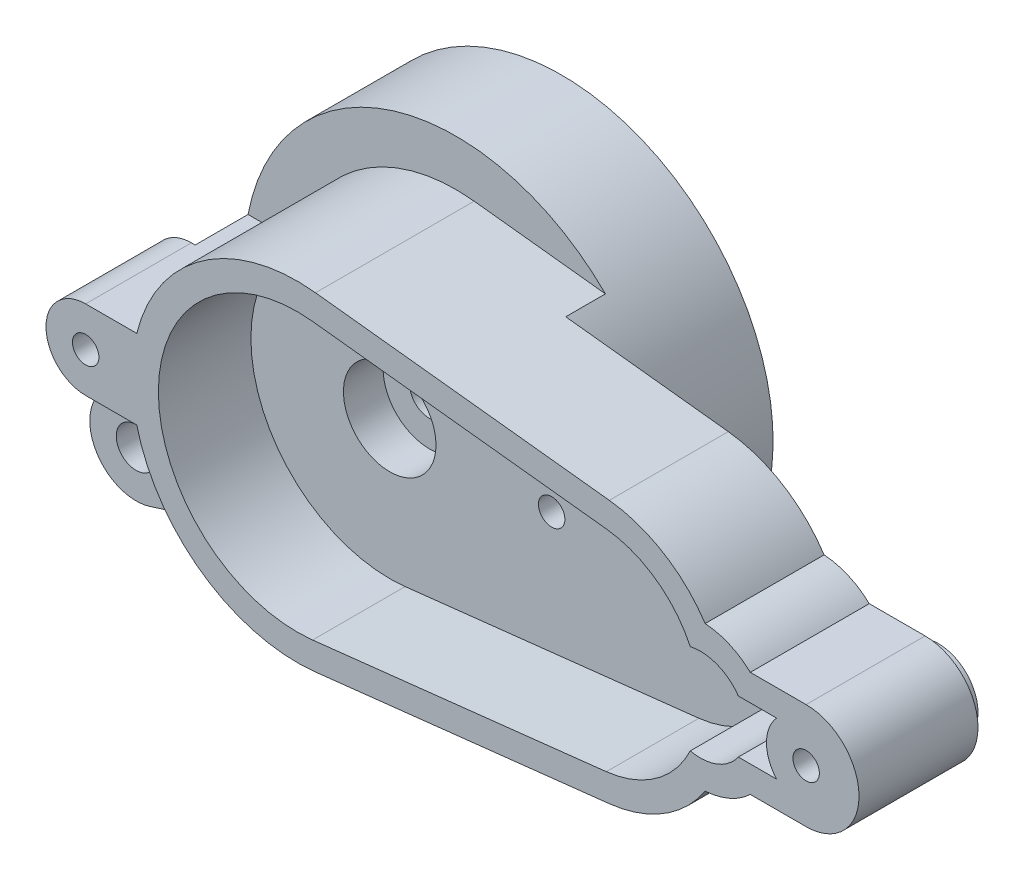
SolidWorks part; units mm, degrees
ref_plane "Face" through (0, 0, 0) normal (0, 0, 1) x (1, 0, 0)
ref_plane "Dessus" through (0, 0, 0) normal (0, 1, 0) x (1, 0, 0)
ref_plane "Droite" through (0, 0, 0) normal (1, 0, 0) x (0, 0, -1)
sketch "Esquisse1" plane through (0, 0, 0) normal (0, 0, 1) x (1, 0, 0)
  line L0 (8, 0) -> (0, 0) construction
  line L1 (8, 4) -> (3.7749, 4)
  line L2 (8, -4) -> (3.7749, -4)
  line L7 (-6.8889, 9.9381) -> (-29.1111, 12.4226)
  line L8 (-29.1111, -12.4226) -> (-6.8889, -9.9381)
  arc A0 (-6.8889, 9.9381) -> (0.3594, 5.4882) centre (-8, 0) cw
  arc A1 (0.3594, -5.4882) -> (3.7749, -4) centre (0, 0) ccw
  arc A2 (0.3594, -5.4882) -> (-6.8889, -9.9381) centre (-8, 0) cw
  arc A3 (8, -4) -> (8, 4) centre (8, 0) ccw
  arc A4 (3.7749, 4) -> (0.3594, 5.4882) centre (0, 0) ccw
  arc A8 (-29.1111, 12.4226) -> (-29.1111, -12.4226) centre (-30.5, 0) ccw
  dimension "D2" = 11
  dimension "D1" = 12.5
  dimension "D3" = 10
  dimension "D6" = 8
  dimension "D4" = 30.5
  dimension "D5" = 8
  dimension "D7" = 8
extrude "Forme de base" add sketch "Esquisse1" against normal blind 9
shell "Coque1" thickness 2
sketch "Esquisse2" plane through (0, 0, 0) normal (0, 0, 1) x (1, 0, 0)
  circle A0 centre (8, 0) radius 3
  arc A1 (8, -4) -> (8, 4) centre (8, 0) ccw construction
  dimension "D1" = 6
extrude "Bossage" add sketch "Esquisse2" against normal blind 10
sketch "Esquisse3" plane through (0, 0, 0) normal (0, 0, 1) x (1, 0, 0)
  circle A0 centre (8, 0) radius 1
  arc A1 (8, -4) -> (8, 4) centre (8, 0) ccw construction
  dimension "D1" = 2
extrude "Trou vis extreme" cut sketch "Esquisse3" against normal through all
sketch "Esquisse4" plane through (0, 0, -7) normal (0, 0, 1) x (1, 0, 0)
  circle A0 centre (0, 0) radius 1.5
  dimension "D1" = 3
extrude "Passage axe moteur" cut sketch "Esquisse4" against normal through all
sketch "Esquisse5" plane through (0, 0, -9) normal (0, 0, -1) x (-1, 0, 0)
  circle A0 centre (8, 0) radius 2.5
  arc A1 (6.8889, 9.9381) -> (-0.3594, 5.4882) centre (8, 0) ccw construction
  dimension "D1" = 5
extrude "Bossage axe intermédiaire" add sketch "Esquisse5" along normal blind 2
sketch "Esquisse6" plane through (0, 0, -7) normal (0, 0, 1) x (1, 0, 0)
  circle A0 centre (-8, 0) radius 1
  circle A1 centre (-8, 0) radius 2.5 construction
  dimension "D1" = 2
extrude "Logement axe intermédiaire" cut sketch "Esquisse6" against normal blind 3
pattern_linear "Répétition linéaire1" count 2 spacing 10.25 along (-1, 0, 0)
sketch "Esquisse7" plane through (0, 0, -9) normal (0, 0, -1) x (-1, 0, 0)
  line L4 (-8, -4) -> (-3.7749, -4)
  line L5 (6.8889, -9.9381) -> (29.1111, -12.4226)
  line L6 (29.1111, 12.4226) -> (6.8889, 9.9381)
  line L7 (-3.7749, 4) -> (-8, 4)
  line L9 (19.1855, -11.3129) -> (29.1111, -12.4226)
  line L10 (29.1111, 12.4226) -> (19.1855, 11.3129)
  arc A0 (19.1855, 11.3129) -> (19.1855, -11.3129) centre (30.5, 0) ccw
  arc A1 (29.1111, -12.4226) -> (29.1111, 12.4226) centre (30.5, 0) ccw construction
  arc A8 (-8, 4) -> (-8, -4) centre (-8, 0) ccw
  arc A9 (-3.7749, -4) -> (-0.3594, -5.4882) centre (0, 0) ccw
  arc A10 (-0.3594, -5.4882) -> (6.8889, -9.9381) centre (8, 0) ccw
  arc A11 (29.1111, -12.4226) -> (29.1111, 12.4226) centre (30.5, 0) ccw
  arc A12 (6.8889, 9.9381) -> (-0.3594, 5.4882) centre (8, 0) ccw
  arc A13 (-0.3594, 5.4882) -> (-3.7749, 4) centre (0, 0) ccw
  arc A17 (29.1111, -12.4226) -> (29.1111, 12.4226) centre (30.5, 0) ccw
  dimension "D1" = 32
  dimension "D2" = 0
extrude "Logement axe de sortie" add sketch "Esquisse7" along normal blind 3 thin
sketch "Esquisse8" plane through (0, 0, -12) normal (0, 0, -1) x (-1, 0, 0)
  circle A0 centre (30.5, 0) radius 16
  arc A2 (19.1855, 11.3129) -> (19.1855, -11.3129) centre (30.5, 0) ccw construction
extrude "Logement de sortie" add sketch "Esquisse8" along normal blind 8 thin
sketch "Esquisse9" plane through (0, 0, -12) normal (0, 0, -1) x (-1, 0, 0)
  line L4 (29.1111, 12.4226) -> (22.8454, 11.7221)
  line L5 (20.1305, 9.4061) -> (29.3333, 10.435)
  line L6 (29.3333, -10.435) -> (20.1305, -9.4061)
  line L7 (22.8454, -11.7221) -> (29.1111, -12.4226)
  line L9 (20.1305, 9.4061) -> (29.3333, 10.435)
  line L10 (29.3333, -10.435) -> (20.1305, -9.4061)
  circle A0 centre (30.5, 0) radius 14 construction
  arc A1 (22.8454, -11.7221) -> (22.8454, 11.7221) centre (30.5, 0) ccw
  arc A4 (22.8454, 11.7221) -> (20.1305, 9.4061) centre (30.5, 0) ccw
  arc A5 (29.3333, -10.435) -> (29.3333, 10.435) centre (30.5, 0) ccw
  arc A6 (20.1305, -9.4061) -> (22.8454, -11.7221) centre (30.5, 0) ccw
  arc A7 (29.1111, -12.4226) -> (29.1111, 12.4226) centre (30.5, 0) ccw
  arc A8 (22.8454, 11.7221) -> (20.1305, 9.4061) centre (30.5, 0) ccw
  arc A9 (29.3333, -10.435) -> (29.3333, 10.435) centre (30.5, 0) ccw
  arc A10 (20.1305, -9.4061) -> (22.8454, -11.7221) centre (30.5, 0) ccw
  dimension "D1" = 0
extrude "Fond intermédiaire logement" add sketch "Esquisse9" along normal blind 2
sketch "Esquisse10" plane through (0, 0, -9) normal (0, 0, -1) x (-1, 0, 0)
  circle A0 centre (30.5, 0) radius 5
  arc A1 (29.3333, -10.435) -> (29.3333, 10.435) centre (30.5, 0) ccw construction
  dimension "D1" = 10
extrude "Bossage sortie" add sketch "Esquisse10" along normal blind 2
sketch "Esquisse11" plane through (0, 0, -7) normal (0, 0, 1) x (1, 0, 0)
  circle A0 centre (-30.5, 0) radius 3.5
  arc A1 (-29.3333, 10.435) -> (-29.3333, -10.435) centre (-30.5, 0) ccw construction
  dimension "D1" = 7
extrude "Logement coussinet sortie" cut sketch "Esquisse11" against normal blind 3
sketch "Esquisse12" plane through (0, 0, -11) normal (0, 0, -1) x (-1, 0, 0)
  circle A0 centre (30.5, 0) radius 1.5
  circle A1 centre (30.5, 0) radius 5 construction
  dimension "D1" = 3
extrude "Passage axe sortie" cut sketch "Esquisse12" against normal through all
sketch "Esquisse13" plane through (0, 0, 0) normal (0, 0, 1) x (1, 0, 0)
  line L0 (-42.6347, 3) -> (-46.5, 3)
  line L1 (-46.5, -3) -> (-42.6347, -3)
  line L2 (-30.5, 0) -> (-46.5, 0) construction
  arc A1 (-29.1111, 12.4226) -> (-29.1111, -12.4226) centre (-30.5, 0) ccw construction
  arc A2 (-46.5, 3) -> (-46.5, -3) centre (-46.5, 0) ccw
  arc A3 (-42.6347, 3) -> (-42.6347, -3) centre (-30.5, 0) ccw
  point P1 (0, 0)
  dimension "D2" = 3
  dimension "D1" = 16
extrude "Bossage vis extrême" add sketch "Esquisse13" against normal blind 8
sketch "Esquisse14" plane through (0, 0, 0) normal (0, 0, 1) x (1, 0, 0)
  circle A0 centre (-46.5, 0) radius 1
  arc A1 (-46.5, 3) -> (-46.5, -3) centre (-46.5, 0) ccw construction
  dimension "D1" = 2
extrude "Vissage vis extrême" cut sketch "Esquisse14" against normal blind 6
sketch "Esquisse15" plane through (0, 0, -12) normal (0, 0, 1) x (1, 0, 0)
  line L0 (-42.6347, 3) -> (-46.5, 3) construction
  line L1 (-42.6347, 3) -> (-46.2162, 3)
  line L2 (-39.9355, -10.3427) -> (-41.2834, -11.8203)
  line L3 (-46.5, -3) -> (-42.6347, -3) construction
  line L4 (-42.6347, 3) -> (-42.6347, -3)
  line L5 (-44.1748, -3) -> (-42.6347, -3)
  line L6 (-30.5, 0) -> (-42.6347, 0) construction
  line L7 (-30.5, 0) -> (-42.6244, -7) construction
  line L8 (-42.6244, -7) -> (-39.9355, -10.3427) construction
  line L9 (-42.6244, -7) -> (-44.1748, -3) construction
  arc A0 (-19.1855, 11.3129) -> (-19.1855, -11.3129) centre (-30.5, 0) ccw construction
  arc A1 (-46.2162, 3) -> (-41.2834, -11.8203) centre (-30.5, 0) ccw
  arc A2 (-39.9355, -10.3427) -> (-44.1748, -3) centre (-30.5, 0) cw
  dimension "D1" = 14
  dimension "D2" = 30
extrude "Remplissage" add sketch "Esquisse15" along normal up to surface (4 mm away)
sketch "Esquisse17" plane through (0, 0, -8) normal (0, 0, 1) x (1, 0, 0)
  line L0 (-42.6244, -7) -> (-48.6865, -10.5) construction
  line L1 (-30.5, 0) -> (-42.6244, -7) construction
  line L2 (-39.9355, -10.3427) -> (-41.2834, -11.8203) construction
  line L3 (-39.9355, -10.3427) -> (-41.2834, -11.8203)
  line L4 (-46.5, -3) -> (-42.6347, -3) construction
  line L5 (-46.5, -3) -> (-44.1748, -3)
  line L6 (-46.5, -3) -> (-51.2517, -8.1188)
  line L7 (-41.2834, -11.8203) -> (-47.6267, -13.8357)
  circle A0 centre (-48.6865, -10.5) radius 1.5
  arc A1 (-44.1748, -3) -> (-39.9355, -10.3427) centre (-30.5, 0) ccw construction
  arc A2 (-44.1748, -3) -> (-39.9355, -10.3427) centre (-30.5, 0) ccw
  arc A3 (-51.2517, -8.1188) -> (-47.6267, -13.8357) centre (-48.6865, -10.5) ccw
  dimension "D1" = 3
  dimension "D3" = 3.5
  dimension "D2" = 21
extrude "Fixation brosse" add sketch "Esquisse17" along normal blind 2
